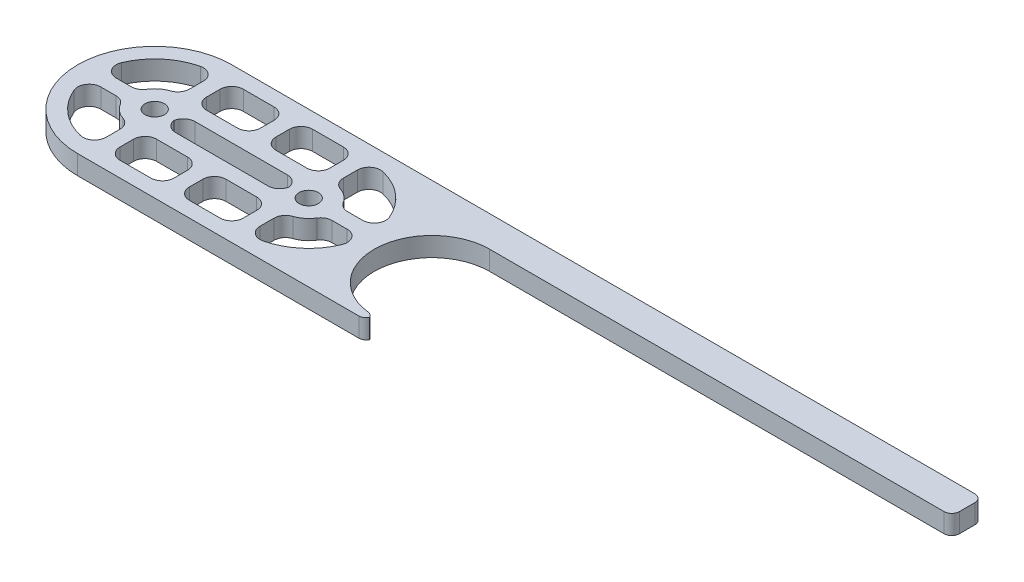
SolidWorks part; units mm, degrees
ref_plane "Front Plane" through (0, 0, 0) normal (0, 0, 1) x (1, 0, 0)
ref_plane "Top Plane" through (0, 0, 0) normal (0, 1, 0) x (1, 0, 0)
ref_plane "Right Plane" through (0, 0, 0) normal (1, 0, 0) x (0, 0, -1)
sketch "Sketch1" plane through (0, 0, 0) normal (0, 1, 0) x (1, 0, 0)
  line L1 (0, 0) -> (50.8, 0)
  line L2 (0, 0) -> (0, 25.4)
  line L3 (0, 25.4) -> (50.8, 25.4)
  line L4 (50.8, 0) -> (50.8, 25.4)
  dimension "D1" = 25.4
  dimension "D2" = 50.8
extrude "Boss-Extrude1" add sketch "Sketch1" along normal blind 3.175
fillet "Fillet1" radius 12.7 4 edges at (0, 1.5875, 0) (0, 1.5875, -25.4) (50.8, 1.5875, -25.4) (50.8, 1.5875, 0)
sketch "Sketch2" plane through (0, 3.175, 0) normal (0, 1, 0) x (1, 0, 0)
  circle A0 centre (12.7, 12.7) radius 1.5875
  circle A1 centre (38.1, 12.7) radius 1.5875
  arc A2 (0, 12.7) -> (12.7, 0) centre (12.7, 12.7) ccw construction
  arc A4 (38.1, 0) -> (50.8, 12.7) centre (38.1, 12.7) ccw construction
  dimension "D1" = 3.175
  dimension "D2" = 3.175
  dimension "D3" = 0
  dimension "D4" = 25.4
  dimension "D5" = 0
extrude "Cut-Extrude1" cut sketch "Sketch2" against normal blind 3.175
sketch "Sketch3" plane through (0, 0, 0) normal (0, -1, 0) x (1, 0, 0)
  line L0 (12.7, -8.5725) -> (38.1, -8.5725)
  line L1 (12.7, -16.8275) -> (38.1, -16.8275)
  line L2 (12.7, -2.54) -> (38.1, -2.54)
  line L3 (12.7, -22.86) -> (38.1, -22.86)
  circle A0 centre (12.7, -12.7) radius 10.16
  circle A1 centre (38.1, -12.7) radius 10.16
  arc A2 (12.7, 0) -> (0, -12.7) centre (12.7, -12.7) ccw construction
  arc A3 (50.8, -12.7) -> (38.1, 0) centre (38.1, -12.7) ccw construction
  circle A4 centre (12.7, -12.7) radius 4.1275
  circle A5 centre (38.1, -12.7) radius 4.1275
  circle A6 centre (12.7, -12.7) radius 1.5875 construction
  circle A7 centre (38.1, -12.7) radius 1.5875 construction
  dimension "D1" = 2.54
  dimension "D2" = 2.54
  dimension "D3" = 2.54
  dimension "D4" = 2.54
  dimension "D6" = 25.4
  dimension "D5" = 25.4
  dimension "D7" = 0
  dimension "D8" = 25.4
  dimension "D9" = 0
  dimension "D10" = 25.4
  dimension "D11" = 0
extrude "Cut-Extrude2" cut sketch "Sketch3" against normal blind 3.175 contours A4 L0 A0 L1 | A1 L2 A0 L0 | A5 L1 A1 L0 | A1 L1 A0 L3
sketch "Sketch4" plane through (0, 0, 0) normal (0, -1, 0) x (1, 0, 0)
  line L0 (12.7, -2.54) -> (38.1, -2.54) construction
  line L1 (26.67, -2.54) -> (24.13, -2.54)
  line L2 (26.67, -2.54) -> (26.67, -8.5725)
  line L3 (26.67, -8.5725) -> (24.13, -8.5725)
  line L4 (24.13, -2.54) -> (24.13, -8.5725)
  line L5 (12.7, -8.5725) -> (38.1, -8.5725) construction
  line L7 (12.7, -8.5725) -> (15.24, -8.5725)
  line L8 (12.7, -8.5725) -> (12.7, -2.54)
  line L9 (12.7, -2.54) -> (15.24, -2.54)
  line L10 (15.24, -8.5725) -> (15.24, -2.54)
  line L11 (2.54, -11.43) -> (9.525, -11.43)
  line L12 (2.54, -11.43) -> (2.54, -13.97)
  line L13 (2.54, -13.97) -> (9.525, -13.97)
  line L14 (9.525, -11.43) -> (9.525, -13.97)
  circle A0 centre (12.7, -12.7) radius 1.5875 construction
  circle A1 centre (38.1, -12.7) radius 1.5875 construction
  dimension "D1" = 13.97
  dimension "D2" = 13.97
  dimension "D3" = 2.54
  dimension "D4" = 0
  dimension "D5" = 0
  dimension "D6" = 2.54
  dimension "D7" = 1.27
  dimension "D8" = 3.175
  dimension "D9" = 10.16
extrude "Boss-Extrude2" add sketch "Sketch4" against normal blind 3.175
ref_plane "Plane1" through (25.4, 0, 0) normal (1, 0, 0) x (0, 0, -1)
mirror "Mirror1" about plane through (25.4, 0, 0) normal (1, 0, 0) of "Boss-Extrude2"
ref_plane "Plane2" through (0, 0, -12.7) normal (0, 0, 1) x (1, 0, 0)
mirror "Mirror2" about plane through (0, 0, -12.7) normal (0, 0, 1) of "Mirror1", "Boss-Extrude2"
sketch "Sketch5" plane through (0, 0, 0) normal (0, -1, 0) x (1, 0, 0)
  line L1 (15.875, -11.0808) -> (34.925, -11.0808)
  line L2 (15.875, -11.0808) -> (15.875, -14.2557)
  line L3 (15.875, -14.2557) -> (34.925, -14.2557)
  line L4 (34.925, -11.0808) -> (34.925, -14.2557)
  circle A0 centre (12.7, -12.7) radius 1.5875 construction
  circle A1 centre (38.1, -12.7) radius 1.5875 construction
  dimension "D1" = 3.175
  dimension "D2" = 1.5557
  dimension "D3" = 3.175
  dimension "D4" = 3.175
extrude "Cut-Extrude3" cut sketch "Sketch5" against normal blind 3.175
fillet "Fillet2" radius 1.905 36 edges at (2.6197, 1.5875, -11.43) (8.7727, 1.5875, -11.43) (12.7, 1.5875, -8.5725) (12.7, 1.5875, -2.54) (15.24, 1.5875, -8.5725) (15.24, 1.5875, -2.54) (24.13, 1.5875, -2.54) (24.13, 1.5875, -8.5725) (48.1803, 1.5875, -11.43) (42.0273, 1.5875, -11.43) (38.1, 1.5875, -8.5725) (38.1, 1.5875, -2.54) (35.56, 1.5875, -2.54) (35.56, 1.5875, -8.5725) (26.67, 1.5875, -8.5725) (26.67, 1.5875, -2.54) (35.56, 1.5875, -22.86) (24.13, 1.5875, -22.86) (48.1803, 1.5875, -13.97) (35.56, 1.5875, -16.8275) (24.13, 1.5875, -16.8275) (42.0273, 1.5875, -13.97) (38.1, 1.5875, -16.8275) (26.67, 1.5875, -16.8275) (38.1, 1.5875, -22.86) (26.67, 1.5875, -22.86) (15.24, 1.5875, -22.86) (15.24, 1.5875, -16.8275) (12.7, 1.5875, -16.8275) (12.7, 1.5875, -22.86) (8.7727, 1.5875, -13.97) (2.6197, 1.5875, -13.97) (15.875, 1.5875, -14.2557) (34.925, 1.5875, -14.2557) (34.925, 1.5875, -11.0808) (15.875, 1.5875, -11.0808)
sketch "Sketch6" plane through (0, 0, 0) normal (0, -1, 0) x (1, 0, 0)
  line L1 (12.7, 0) -> (38.1, 0) construction
  line L2 (60.325, -1.27) -> (60.325, 0)
  line L3 (60.325, 0) -> (38.1, 0)
  line L4 (38.1, -25.4) -> (136.525, -25.4)
  line L5 (136.525, -25.4) -> (136.525, -20.32)
  line L6 (136.525, -20.32) -> (60.325, -20.32)
  arc A0 (60.325, -1.27) -> (60.325, -20.32) centre (60.325, -10.795) ccw
  arc A1 (50.8, -12.7) -> (38.1, 0) centre (38.1, -12.7) ccw
  arc A2 (38.1, -25.4) -> (50.8, -12.7) centre (38.1, -12.7) ccw
  dimension "D1" = 9.525
  dimension "D3" = 9.525
  dimension "D6" = 90
  dimension "D2" = 9.525
  dimension "D4" = 180
  dimension "D5" = 1.27
  dimension "D7" = 76.2
extrude "Boss-Extrude3" add sketch "Sketch6" against normal blind 3.175
fillet "Fillet3" radius 1.27 4 edges at (136.525, 1.5875, -20.32) (136.525, 1.5875, -25.4) (60.325, 1.5875, -1.27) (60.325, 1.5875, 0)
